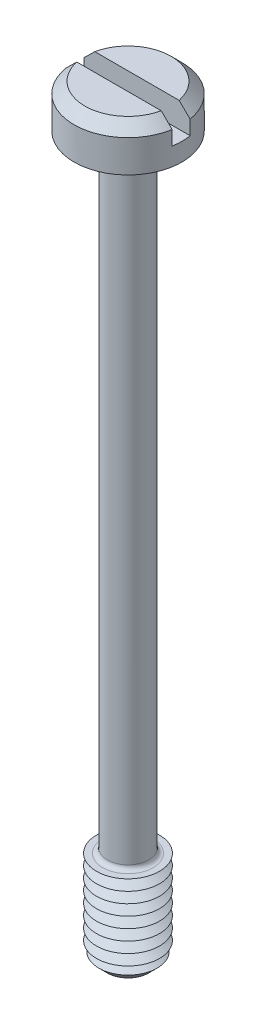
SolidWorks part; units mm, degrees
ref_plane "Front Plane" through (0, 0, 0) normal (0, 0, 1) x (1, 0, 0)
ref_plane "Top Plane" through (0, 0, 0) normal (0, 1, 0) x (1, 0, 0)
ref_plane "Right Plane" through (0, 0, 0) normal (1, 0, 0) x (0, 0, -1)
sketch "Sketch1" plane through (0, 0, 0) normal (0, 1, 0) x (1, 0, 0)
  circle A0 centre (0, 0) radius 3
  dimension "D1" = 6
extrude "Boss-Extrude1" add sketch "Sketch1" along normal blind 2.4
sketch "Sketch2" plane through (0, 0, 0) normal (0, -1, 0) x (1, 0, 0)
  circle A0 centre (0, 0) radius 1.15
  dimension "D1" = 2.3
extrude "Boss-Extrude2" add sketch "Sketch2" along normal blind 40
sketch "Sketch3" plane through (0, -40, 0) normal (0, -1, 0) x (1, 0, 0)
  circle A0 centre (0, 0) radius 1.75
  dimension "D1" = 3.5
extrude "Boss-Extrude3" add sketch "Sketch3" against normal blind 5.2
chamfer "Chamfer1" distance 0.6 angle 45 1 edges at (0, -40, -1.75)
sketch "Sketch4" plane through (0, 0, 0) normal (1, 0, 0) x (0, 0, -1)
  line L0 (0, -6.5871) -> (0, -12.0372) construction
sketch "Sketch5" plane through (0, 0, 0) normal (1, 0, 0) x (0, 0, -1)
  line L0 (-1.75, -34.8) -> (-1.2304, -35.1)
  line L1 (-1.2304, -35.1) -> (-1.75, -35.4)
  line L2 (-1.75, -34.8) -> (-1.75, -39.4) construction
  line L3 (-1.75, -35.4) -> (-1.75, -34.8)
  dimension "D1" = 0.6
revolve "Cut-Revolve1" cut sketch "Sketch5" angle 360 about L0
pattern_linear "LPattern1" count 8 spacing 0.6 along (0, -1, 0) of "Cut-Revolve1"
fillet "Fillet1" radius 0.25 2 edges at (0, -34.8, -1.15) (0, 0, -1.15)
chamfer "Chamfer2" distance 0.6 angle 45 1 edges at (0, 2.4, 3)
sketch "Sketch6" plane through (0, 2.4, 0) normal (0, 1, 0) x (1, 0, 0)
  line L1 (3, -0.5) -> (-3, -0.5)
  line L2 (3, -0.5) -> (3, 0.5)
  line L3 (3, 0.5) -> (-3, 0.5)
  line L4 (-3, -0.5) -> (-3, 0.5)
  line L5 (3, -0.5) -> (-3, 0.5) construction
  line L6 (3, 0.5) -> (-3, -0.5) construction
  circle A0 centre (0, 0) radius 3 construction
  point P0 (0, 0)
  dimension "D1" = 1
extrude "Cut-Extrude1" cut sketch "Sketch6" against normal blind 1.4
